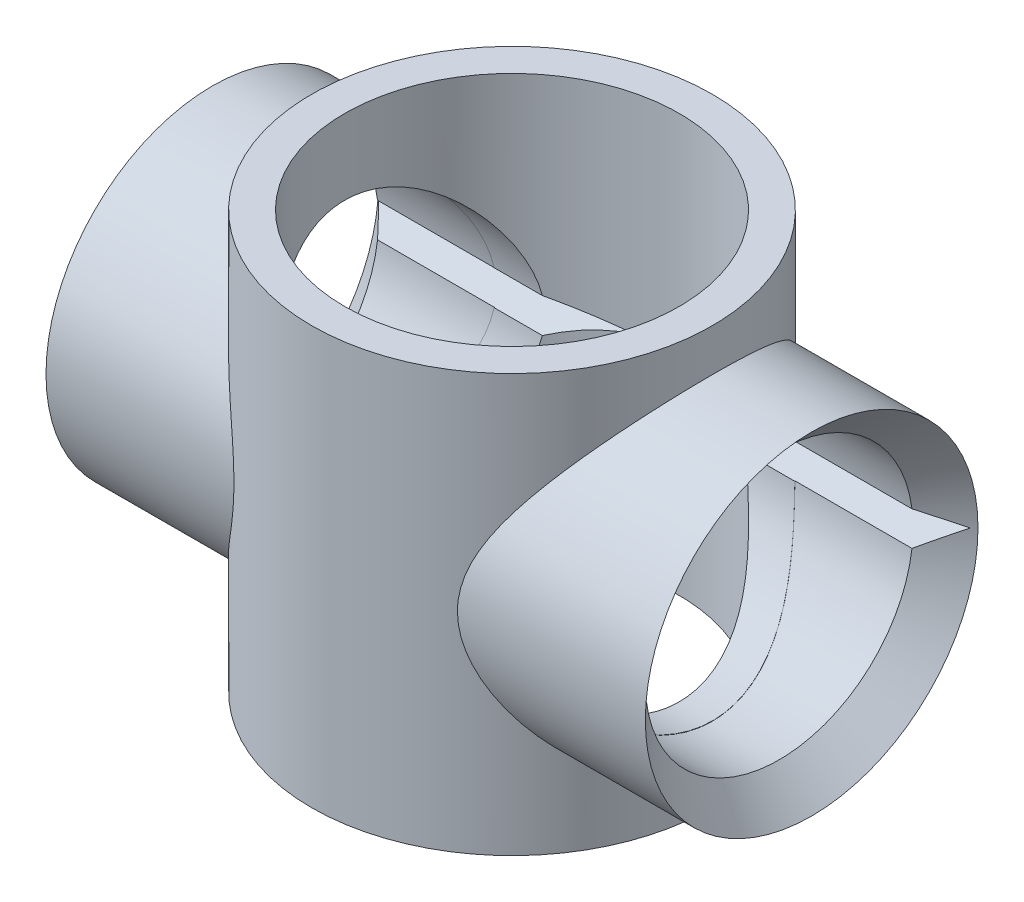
SolidWorks part; units mm, degrees
ref_plane "Front Plane" through (0, 0, 0) normal (0, 0, 1) x (1, 0, 0)
ref_plane "Top Plane" through (0, 0, 0) normal (0, 1, 0) x (1, 0, 0)
ref_plane "Right Plane" through (0, 0, 0) normal (1, 0, 0) x (0, 0, -1)
sketch "Sketch1" plane through (0, 0, 0) normal (0, 1, 0) x (1, 0, 0)
  circle A0 centre (0, 0) radius 19.05
  circle A1 centre (0, 0) radius 15.9004
  dimension "D1" = 38.1
  dimension "D2" = 31.8008
extrude "Boss-Extrude1" add sketch "Sketch1" along normal mid plane 39.6875
sketch "Sketch3" plane through (0, 0, 0) normal (1, 0, 0) x (0, 0, -1)
  circle A0 centre (0, 0) radius 12.7254
  circle A1 centre (0, 0) radius 15.8115
  dimension "D1" = 25.4508
  dimension "D2" = 31.623
extrude "Boss-Extrude2" add sketch "Sketch3" along normal mid plane 50.8
sketch "Sketch5" plane through (0, 19.8438, 0) normal (0, 1, 0) x (1, 0, 0)
  circle A0 centre (0, 0) radius 15.9004
  dimension "D1" = 31.8008
extrude "Cut-Extrude2" cut sketch "Sketch5" against normal through all
sketch "Sketch6" plane through (25.4, 0, 0) normal (1, 0, 0) x (0, 0, -1)
  line L0 (-12.7, 0) -> (-15.24, 0) construction
  line L1 (-15.24, 0) -> (-12.6088, 1.5191)
  line L2 (-15.24, 0) -> (-12.6088, -1.5191)
  line L4 (12.7, 0) -> (15.24, 0) construction
  line L5 (15.24, 0) -> (12.6088, -1.5191)
  line L6 (15.24, 0) -> (12.6088, 1.5191)
  arc A0 (-12.6088, -1.5191) -> (12.6088, -1.5191) centre (0, 0) ccw
  arc A1 (12.6088, 1.5191) -> (-12.6088, 1.5191) centre (0, 0) ccw
  dimension "D1" = 25.4
  dimension "D8" = 15.24
  dimension "D2" = 30
  dimension "D3" = 60
  dimension "D4" = 2.54
  dimension "D5" = 2.54
  dimension "D6" = 30
  dimension "D7" = 60
  dimension "D9" = 15.24
extrude "Cut-Extrude3" cut sketch "Sketch6" against normal blind 50.8
sketch "Sketch8" plane through (0, 0, 0) normal (0, 0, 1) x (1, 0, 0)
  line L1 (-25.4, 15.8115) -> (-28.4861, 15.8115)
  line L2 (-28.4861, 15.8115) -> (-25.4, 12.7254)
  line L3 (-25.4, 12.7254) -> (-25.4, 15.8115)
  line L4 (25.4, 15.8115) -> (28.4861, 15.8115)
  line L5 (28.4861, 15.8115) -> (25.4, 12.7254)
  line L6 (25.4, 12.7254) -> (25.4, 15.8115)
  dimension "D1" = 45
  dimension "D2" = 45
revolve "Revolve3" add sketch "Sketch8" angle 360 about axis through (25.4, 0, 0) along (-1, 0, 0)
sketch "Sketch9" plane through (0, 0, 0) normal (1, 0, 0) x (0, 0, -1)
  line L0 (-15.44, 0) -> (-12.5363, 0) construction
  line L1 (-12.7254, 0) -> (-12.5363, 0) construction
  line L4 (-12.5363, 1.6765) -> (-15.44, 0)
  line L5 (-15.44, 0) -> (-12.5363, -1.6765)
  line L6 (-12.5363, -1.6765) -> (-12.5363, 1.6765)
  arc A1 (-12.6363, 1.5032) -> (-12.6363, -1.5032) centre (0, 0) ccw construction
  dimension "D2" = 3.3529
  dimension "D1" = 0.1891
extrude "Cut-Extrude4" cut sketch "Sketch9" against normal through all and the other way through all
mirror "Mirror1" about plane through (0, 0, 0) normal (0, 0, 1) of "Cut-Extrude4"
